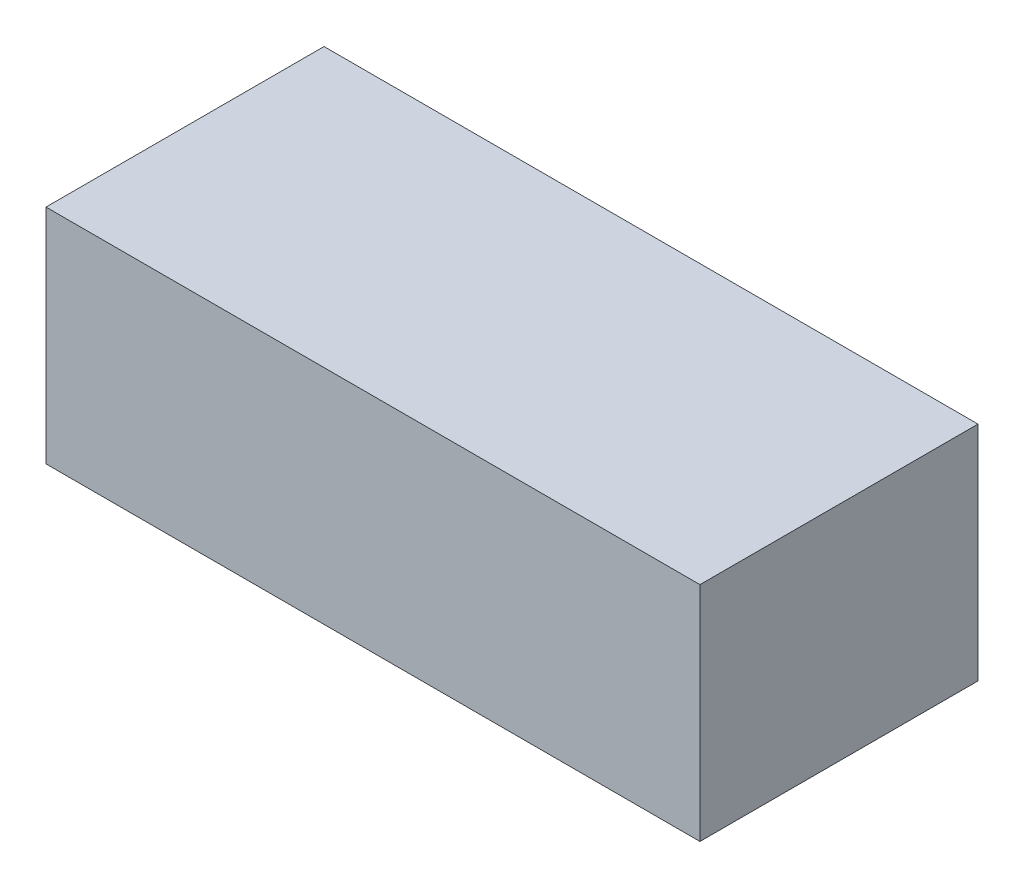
SolidWorks part; units mm, degrees
ref_plane "Plan de face" through (0, 0, 0) normal (0, 0, 1) x (1, 0, 0)
ref_plane "Plan de dessus" through (0, 0, 0) normal (0, 1, 0) x (1, 0, 0)
ref_plane "Plan de droite" through (0, 0, 0) normal (1, 0, 0) x (0, 0, -1)
sketch "Esquisse1" plane through (0, 0, 0) normal (0, 1, 0) x (1, 0, 0)
  line L1 (1.47, -0.625) -> (-1.47, -0.625)
  line L2 (1.47, -0.625) -> (1.47, 0.625)
  line L3 (1.47, 0.625) -> (-1.47, 0.625)
  line L4 (-1.47, -0.625) -> (-1.47, 0.625)
  line L5 (1.47, -0.625) -> (-1.47, 0.625) construction
  line L6 (1.47, 0.625) -> (-1.47, -0.625) construction
  point P0 (0, 0)
  dimension "D1" = 1.25
  dimension "D2" = 2.94
extrude "Boss.-Extru.1" add sketch "Esquisse1" along normal blind 1
